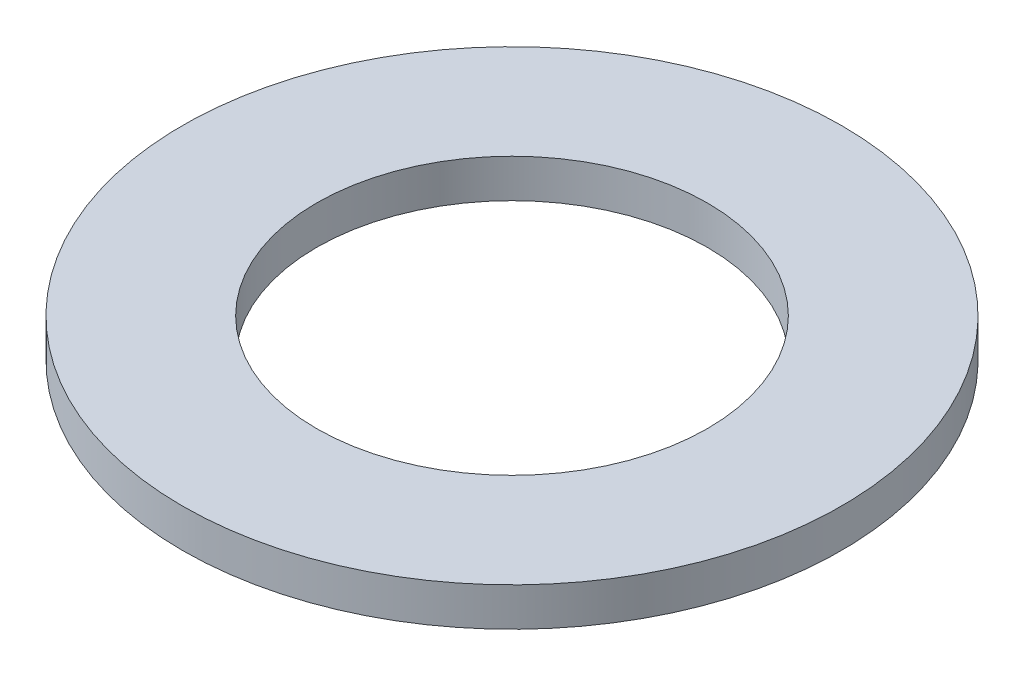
SolidWorks part; units mm, degrees
ref_plane "Front Plane" through (0, 0, 0) normal (0, 0, 1) x (1, 0, 0)
ref_plane "Top Plane" through (0, 0, 0) normal (0, 1, 0) x (1, 0, 0)
ref_plane "Right Plane" through (0, 0, 0) normal (1, 0, 0) x (0, 0, -1)
sketch "Sketch1" plane through (0, 0, 0) normal (0, 1, 0) x (1, 0, 0)
  circle A0 centre (0, 0) radius 27.178
  circle A1 centre (0, 0) radius 16.1163
  dimension "D1" = 54.356
  dimension "D2" = 32.2326
extrude "Boss-Extrude1" add sketch "Sketch1" along normal blind 3.175 contours A0 A1
